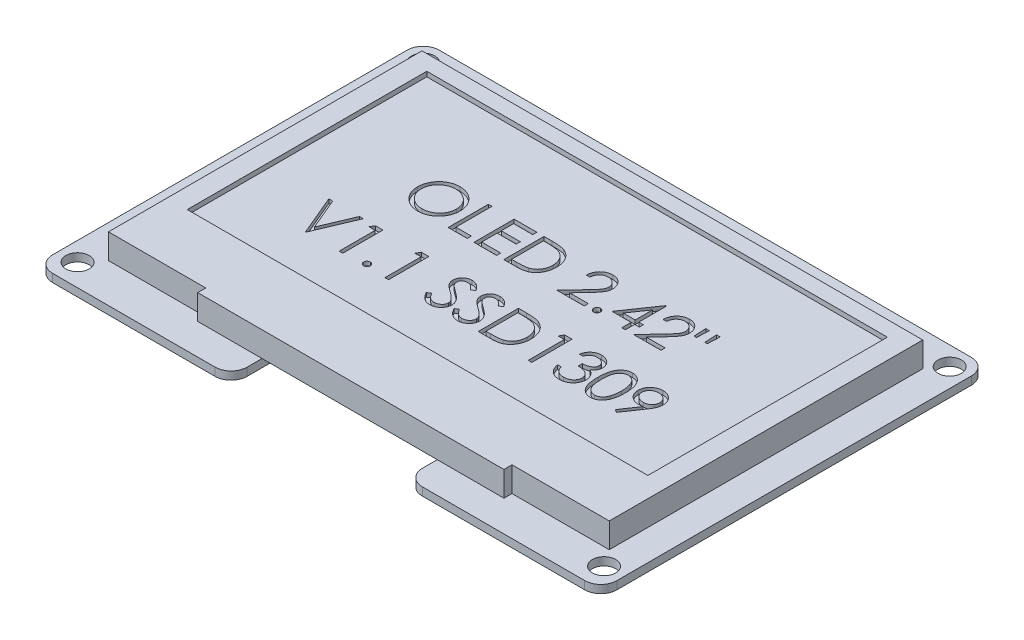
SolidWorks part; units mm, degrees
ref_plane "Front Plane" through (0, 0, 0) normal (0, 0, 1) x (1, 0, 0)
ref_plane "Top Plane" through (0, 0, 0) normal (0, 1, 0) x (1, 0, 0)
ref_plane "Right Plane" through (0, 0, 0) normal (1, 0, 0) x (0, 0, -1)
sketch "Sketch1" plane through (0, 0, 0) normal (0, 1, 0) x (1, 0, 0)
  line L0 (0, 0) -> (0, -16.82) construction
  line L1 (-33.1, -24.05) -> (-12.9, -24.05)
  line L2 (-35.1, -22.05) -> (-35.1, 22.05)
  line L3 (-33.1, 24.05) -> (33.1, 24.05)
  line L4 (35.1, -22.05) -> (35.1, 22.05)
  line L5 (-35.1, -24.05) -> (35.1, 24.05) construction
  line L6 (-35.1, 24.05) -> (35.1, -24.05) construction
  line L8 (-10.9, -22.05) -> (-10.9, -18.82)
  line L9 (-8.9, -16.82) -> (8.9, -16.82)
  line L10 (10.9, -22.05) -> (10.9, -18.82)
  line L11 (12.9, -24.05) -> (33.1, -24.05)
  arc A0 (33.1, 24.05) -> (35.1, 22.05) centre (33.1, 22.05) cw
  arc A1 (33.1, -24.05) -> (35.1, -22.05) centre (33.1, -22.05) ccw
  arc A2 (-33.1, -24.05) -> (-35.1, -22.05) centre (-33.1, -22.05) cw
  arc A3 (-35.1, 22.05) -> (-33.1, 24.05) centre (-33.1, 22.05) cw
  arc A4 (8.9, -16.82) -> (10.9, -18.82) centre (8.9, -18.82) cw
  arc A5 (-10.9, -18.82) -> (-8.9, -16.82) centre (-8.9, -18.82) cw
  arc A6 (12.9, -24.05) -> (10.9, -22.05) centre (12.9, -22.05) cw
  arc A7 (-12.9, -24.05) -> (-10.9, -22.05) centre (-12.9, -22.05) ccw
  point P0 (0, 0)
  point P28 (-10.9, -16.82)
  point P33 (-10.9, -24.05)
  dimension "D5" = 2
  dimension "D6" = 2
  dimension "D1" = 48.1
  dimension "D2" = 70.2
  dimension "D3" = 24.2
  dimension "D4" = 7.23
extrude "Boss-Extrude1" add sketch "Sketch1" along normal blind 1
sketch "Sketch2" plane through (0, 1, 0) normal (0, 1, 0) x (1, 0, 0)
  line L0 (33.1, 24.05) -> (-33.1, 24.05) construction
  line L1 (-31, 19.8) -> (31.3, 19.8)
  line L2 (-31, 19.8) -> (-31, -19.2)
  line L3 (-31, -19.2) -> (31.3, -19.2)
  line L4 (31.3, 19.8) -> (31.3, -19.2)
  line L5 (-18.9, -19.2) -> (19.2, -19.2)
  line L6 (-18.9, -19.2) -> (-18.9, -20.2)
  line L7 (-18.9, -20.2) -> (19.2, -20.2)
  line L8 (19.2, -19.2) -> (19.2, -20.2)
  line L9 (-35.1, 22.05) -> (-35.1, -22.05) construction
  line L10 (35.1, -22.05) -> (35.1, 22.05) construction
  point P8 (0.15, -19.2)
  dimension "D1" = 62.3
  dimension "D2" = 39
  dimension "D3" = 38.1
  dimension "D4" = 40
  dimension "D5" = 4.25
  dimension "D6" = 4.1
  dimension "D7" = 3.8
extrude "Boss-Extrude2" add sketch "Sketch2" along normal blind 3.1 contours L4 L1 L2 L3 M12 M13 M14 M15 M16 | L3 M12 M16 M15 M14 M13 | L7 L3 M12 M16 | L6 L7 L3 M12 | L8 L3 L7 M16
sketch "Sketch3" plane through (0, 1, 0) normal (0, 1, 0) x (1, 0, 0)
  line L0 (0, 24.05) -> (0, 0) construction
  line L1 (33.1, 24.05) -> (-33.1, 24.05) construction
  line L4 (-33.1, -24.05) -> (-12.9, -24.05) construction
  circle A0 centre (-32.75, 21.7) radius 1.45
  circle A1 centre (32.75, 21.7) radius 1.45
  circle A2 centre (32.75, -21.3) radius 1.45
  circle A3 centre (-32.75, -21.3) radius 1.45
  point P8 (0, 0)
  point P16 (0, 0)
  dimension "D1" = 2.9
  dimension "D5" = 2.75
  dimension "D2" = 43
  dimension "D3" = 65.5
  dimension "D4" = 2.35
extrude "Cut-Extrude1" cut sketch "Sketch3" against normal up to next
sketch "Sketch4" plane through (0, 0, 0) normal (0, -1, 0) x (1, 0, 0)
  line L0 (33.1, -24.05) -> (-33.1, -24.05) construction
  line L1 (8.8, -7.45) -> (-8.8, -7.45)
  line L2 (8.8, -7.45) -> (8.8, -2.85)
  line L3 (8.8, -2.85) -> (-8.8, -2.85)
  line L4 (-8.8, -7.45) -> (-8.8, -2.85)
  line L5 (0, 0) -> (0, -2.85) construction
  line L6 (-35.1, -22.05) -> (-35.1, 22.05) construction
  dimension "D1" = 17.6
  dimension "D2" = 4.6
  dimension "D3" = 16.6
  dimension "D4" = 26.3
extrude "Boss-Extrude3" add sketch "Sketch4" along normal blind 2
sketch "Sketch5" plane through (0, 0, 0) normal (0, -1, 0) x (1, 0, 0)
  line L0 (24.1, -17.75) -> (17.1, -17.75) construction
  line L1 (24.1, -19.75) -> (17.1, -19.75)
  line L2 (24.1, -15.75) -> (17.1, -15.75)
  line L3 (35.1, 22.05) -> (35.1, -22.05) construction
  line L4 (33.1, -24.05) -> (-33.1, -24.05) construction
  line L5 (0, 0) -> (0, -24.05) construction
  line L6 (-17.1, -17.75) -> (-24.1, -17.75) construction
  line L7 (-17.1, -19.75) -> (-24.1, -19.75)
  line L8 (-17.1, -15.75) -> (-24.1, -15.75)
  line L9 (-17.1, 17.85) -> (-24.1, 17.85) construction
  line L10 (-17.1, 15.85) -> (-24.1, 15.85)
  line L11 (-17.1, 19.85) -> (-24.1, 19.85)
  line L12 (24.1, 17.85) -> (17.1, 17.85) construction
  line L13 (24.1, 15.85) -> (17.1, 15.85)
  line L14 (24.1, 19.85) -> (17.1, 19.85)
  line L15 (12.9, 24.05) -> (33.1, 24.05) construction
  arc A0 (24.1, -19.75) -> (24.1, -15.75) centre (24.1, -17.75) ccw
  arc A1 (17.1, -15.75) -> (17.1, -19.75) centre (17.1, -17.75) ccw
  arc A2 (-17.1, -19.75) -> (-17.1, -15.75) centre (-17.1, -17.75) ccw
  arc A3 (-24.1, -15.75) -> (-24.1, -19.75) centre (-24.1, -17.75) ccw
  arc A4 (-17.1, 15.85) -> (-17.1, 19.85) centre (-17.1, 17.85) ccw
  arc A5 (-24.1, 19.85) -> (-24.1, 15.85) centre (-24.1, 17.85) ccw
  arc A6 (24.1, 15.85) -> (24.1, 19.85) centre (24.1, 17.85) ccw
  arc A7 (17.1, 19.85) -> (17.1, 15.85) centre (17.1, 17.85) ccw
  point P2 (20.6, -17.75)
  point P7 (26.1, -17.75)
  point P19 (-20.6, -17.75)
  point P26 (-20.6, 17.85)
  point P33 (20.6, 17.85)
  dimension "D1" = 4
  dimension "D2" = 7
  dimension "D3" = 9
  dimension "D4" = 4.3
  dimension "D7" = 4.2
  dimension "D5" = 2
  dimension "D6" = 2
extrude "Boss-Extrude4" add sketch "Sketch5" along normal blind 2
sketch "Sketch6" plane through (0, 4.1, 0) normal (0, 1, 0) x (1, 0, 0)
  line L0 (-31, 19.8) -> (31.3, 19.8) construction
  line L1 (-28.5, 17.9) -> (28.8, 17.9)
  line L2 (-28.5, 17.9) -> (-28.5, -11.9)
  line L3 (-28.5, -11.9) -> (28.8, -11.9)
  line L4 (28.8, 17.9) -> (28.8, -11.9)
  line L5 (31.3, 19.8) -> (31.3, -19.2) construction
  line L6 (-31, 19.8) -> (-31, -19.2) construction
  line L7 (-31, -19.2) -> (-18.9, -19.2) construction
  dimension "D1" = 1.9
  dimension "D2" = 2.5
  dimension "D3" = 2.5
  dimension "D4" = 7.3
  dimension "D5" = 29.8
extrude "Cut-Extrude2" cut sketch "Sketch6" against normal blind 0.6
sketch "Sketch7" plane through (0, 3.5, 0) normal (0, 1, 0) x (1, 0, 0)
  line L0 (-28.5, 3) -> (28.8, 3) construction
  line L1 (-28.5, 17.9) -> (-28.5, -11.9) construction
  line L2 (28.8, -11.9) -> (28.8, 17.9) construction
  text T0 "OLED 2.42\"  V1.1 SSD1309" font "Century Gothic" height 5
extrude "Cut-Extrude3" cut sketch "Sketch7" against normal blind 0.5
sketch "Sketch8" plane through (0, 1, 0) normal (0, 1, 0) x (1, 0, 0)
  line L0 (-33.1, -24.05) -> (-12.9, -24.05) construction
  line L1 (-35.1, 22.05) -> (-35.1, -22.05) construction
  line L2 (33.1, 24.05) -> (-33.1, 24.05) construction
  line L3 (0, 0) -> (0, 24.05) construction
  circle A0 centre (-32.9, -3.75) radius 0.45
  circle A1 centre (-32.9, -1.21) radius 0.45
  circle A2 centre (-32.9, 1.33) radius 0.45
  circle A3 centre (-32.9, 3.87) radius 0.45
  circle A4 centre (-3.81, 21.85) radius 0.45
  circle A5 centre (-1.27, 21.85) radius 0.45
  circle A6 centre (1.27, 21.85) radius 0.45
  circle A7 centre (3.81, 21.85) radius 0.45
  point P25 (0, 0)
  point P26 (-2.0057, 21.85)
  dimension "D1" = 0.9
  dimension "D2" = 20.3
  dimension "D4" = 2.54
  dimension "D5" = 2.2
  dimension "D6" = 2.2
  dimension "D8" = 2.54
  dimension "D3" = 4
  dimension "D7" = 4
extrude "Cut-Extrude4" cut sketch "Sketch8" against normal through all
